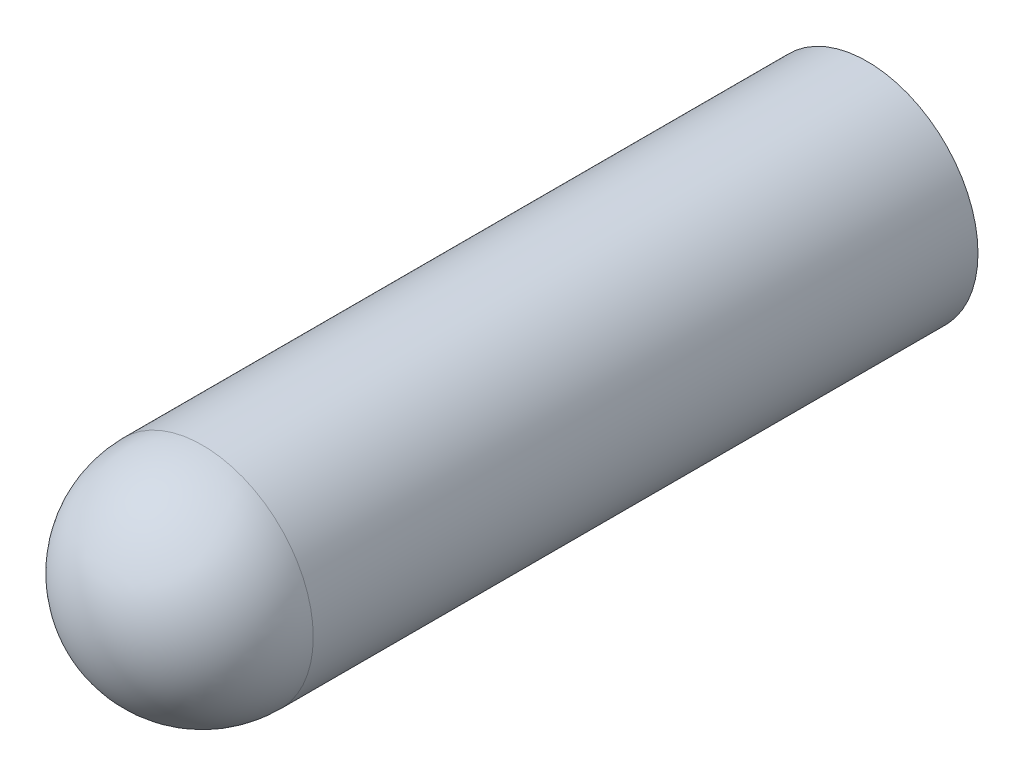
SolidWorks part; units mm, degrees
ref_plane "Front Plane" through (0, 0, 0) normal (0, 0, 1) x (1, 0, 0)
ref_plane "Top Plane" through (0, 0, 0) normal (0, 1, 0) x (1, 0, 0)
ref_plane "Right Plane" through (0, 0, 0) normal (1, 0, 0) x (0, 0, -1)
sketch "Sketch1" plane through (0, 0, 0) normal (0, 0, 1) x (1, 0, 0)
  circle A0 centre (0, 0) radius 6.35
  dimension "D1" = 12.7
extrude "Boss-Extrude1" add sketch "Sketch1" along normal blind 38.1
sketch "Sketch2" plane through (0, 0, 38.1) normal (0, 0, 1) x (1, 0, 0)
  line L0 (-6.35, 0) -> (6.35, 0)
  arc A0 (6.35, 0) -> (-6.35, 0) centre (0, 0) ccw
  circle A1 centre (0, 0) radius 6.35 construction
revolve "Revolve1" add sketch "Sketch2" angle 180 about L0
sketch "Sketch3" plane through (0, 0, 0) normal (0, 0, -1) x (-1, 0, 0)
  circle A0 centre (0, 0) radius 1.905
  dimension "D1" = 3.81
extrude "Cut-Extrude1" cut sketch "Sketch3" against normal blind 25.4
